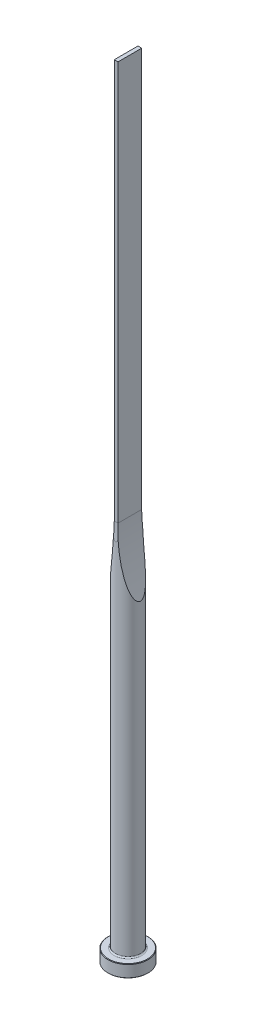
SolidWorks part; units mm, degrees
ref_plane "Front Plane" through (0, 0, 0) normal (0, 0, 1) x (1, 0, 0)
ref_plane "Top Plane" through (0, 0, 0) normal (0, 1, 0) x (1, 0, 0)
ref_plane "Right Plane" through (0, 0, 0) normal (1, 0, 0) x (0, 0, -1)
sketch "Sketch1" plane through (0, 0, 0) normal (0, 0, 1) x (1, 0, 0)
  line L0 (0, 0) -> (7.8, 0)
  line L1 (55, 0) -> (-55, 0) construction
  line L2 (8, 0.2) -> (8, 4.8)
  line L3 (7.8, 5) -> (5.5, 5)
  line L4 (5, 5.5) -> (5, 315)
  line L5 (0, 315) -> (5, 315)
  line L6 (8, 4.8) -> (7.8, 5)
  line L7 (7.8, 0) -> (8, 0.2)
  line L8 (0, 315) -> (0, 0)
  arc A0 (5, 5.5) -> (5.5, 5) centre (5.5, 5.5) ccw
  point P1 (8, 0)
  point P6 (8, 5)
  dimension "D4" = 0.5
  dimension "D1" = 5
  dimension "D2" = 8
  dimension "D3" = 5
  dimension "D5" = 315
revolve "Revolve1" add sketch "Sketch1" angle 360 about L8
sketch "Sketch2" plane through (0, 0, 0) normal (0, 0, 1) x (1, 0, 0)
  line L0 (0.75, 315) -> (0.75, 155)
  line L1 (5, 315) -> (-5, 315) construction
  line L2 (-0.75, 315) -> (-0.75, 155)
  line L3 (5, 315) -> (5, 127.6698)
  line L4 (-5, 315) -> (-5, 127.6698)
  line L5 (0, -8.8) -> (0, 8.8) construction
  line L6 (5, 315) -> (0.75, 315)
  line L8 (-0.75, 315) -> (-5, 315)
  arc A0 (0.75, 155) -> (5, 127.6698) centre (90.75, 155) ccw
  arc A1 (-0.75, 155) -> (-5, 127.6698) centre (-90.75, 155) cw
  dimension "D4" = 90
  dimension "D1" = 160
  dimension "D2" = 1.5
  dimension "D3" = 0.75
extrude "Cut-Extrude1" cut sketch "Sketch2" against normal mid plane 10
sketch "Sketch3" plane through (0, 0, 0) normal (1, 0, 0) x (0, 0, -1)
  line L0 (4.75, 315) -> (4.75, 155)
  line L1 (-4.9434, 315) -> (4.9434, 315) construction
  line L2 (-4.75, 315) -> (-4.75, 155)
  line L3 (5, 315) -> (5, 148.2965)
  line L4 (4.75, 315) -> (5, 315)
  line L5 (0, 8.8) -> (0, -8.8) construction
  line L6 (-5, 315) -> (-5, 148.2965)
  line L8 (-4.75, 315) -> (-5, 315)
  arc A0 (4.75, 155) -> (5, 148.2965) centre (94.75, 155) ccw
  arc A1 (-4.75, 155) -> (-5, 148.2965) centre (-94.75, 155) cw
  dimension "D2" = 90
  dimension "D1" = 160
  dimension "D3" = 9.5
  dimension "D4" = 4.75
extrude "Cut-Extrude2" cut sketch "Sketch3" against normal mid plane 10
